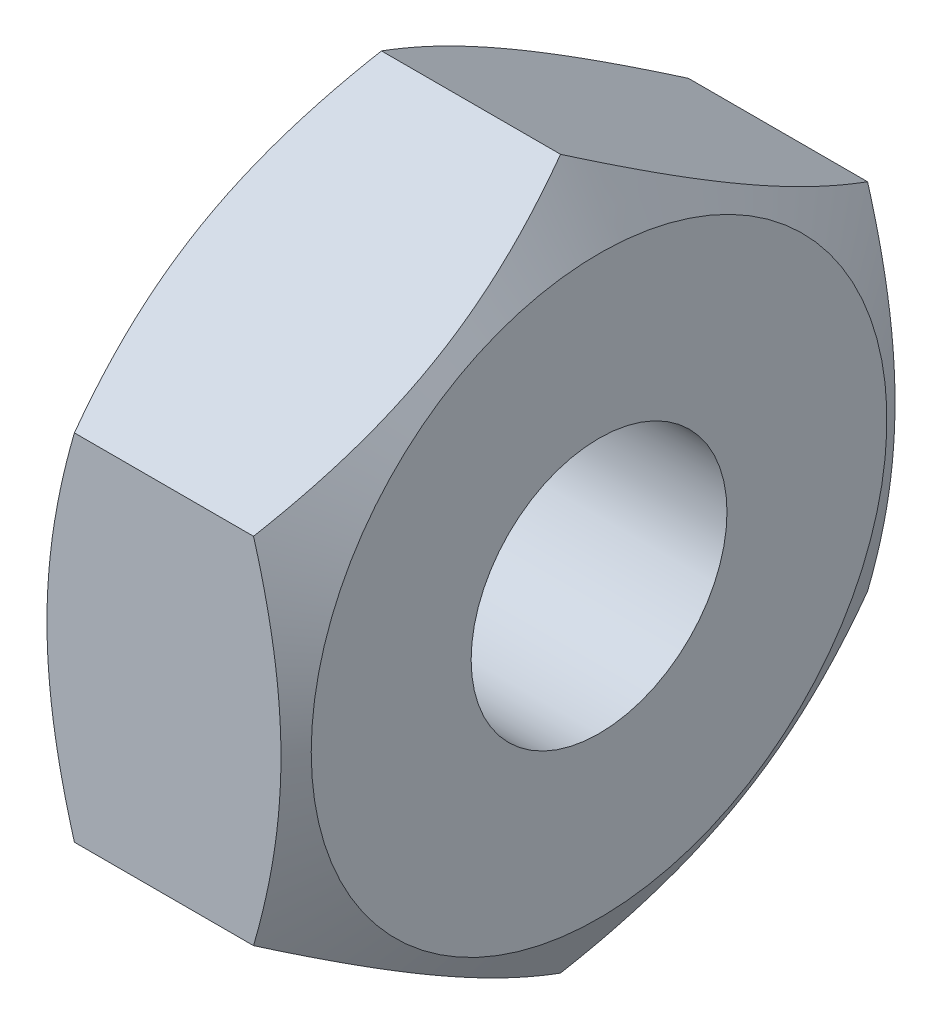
SolidWorks part; units mm, degrees
ref_plane "前视" through (0, 0, 0) normal (0, 0, 1) x (1, 0, 0)
ref_plane "上视" through (0, 0, 0) normal (0, 1, 0) x (1, 0, 0)
ref_plane "右视" through (0, 0, 0) normal (1, 0, 0) x (0, 0, -1)
sketch "草图1" plane through (0, 0, 0) normal (0, 1, 0) x (1, 0, 0)
  line L0 (0, 0) -> (10.0102, 0)
  line L1 (10.0102, 0) -> (10.0102, 11.25)
  line L2 (10.0102, 11.25) -> (8.5051, 13.8568)
  line L3 (8.5051, 13.8568) -> (1.5051, 13.8568)
  line L4 (1.5051, 13.8568) -> (0, 11.25)
  line L5 (0, 11.25) -> (0, 0)
  line L6 (0, 0) -> (10.0102, 0) construction
  point P0 (0, 0)
  dimension "D1" = 7
revolve "旋转1" add sketch "草图1" angle 360 about L6
sketch "草图2" plane through (0, 0, 0) normal (1, 0, 0) x (0, 0, -1)
  line L0 (-12, -6.9284) -> (-12, 6.9284)
  line L1 (-12, 6.9284) -> (0, 13.8568)
  line L2 (0, 13.8568) -> (12, 6.9284)
  line L3 (12, 6.9284) -> (12, -6.9284)
  line L4 (12, -6.9284) -> (0, -13.8568)
  line L5 (0, -13.8568) -> (-12, -6.9284)
  point P0 (0, 0)
extrude "切除-拉伸1" cut sketch "草图2" along normal blind 25 flip side to cut
ref_plane "基准面1" through (0, 0, 0) normal (1, 0, 0) x (0, 0, -1)
sketch "草图3" plane through (0, 0, 0) normal (1, 0, 0) x (0, 0, -1)
  circle A0 centre (0, 0) radius 5
  point P0 (0, 0)
  dimension "D1" = 10
extrude "切除-拉伸2" cut sketch "草图3" along normal blind 25
